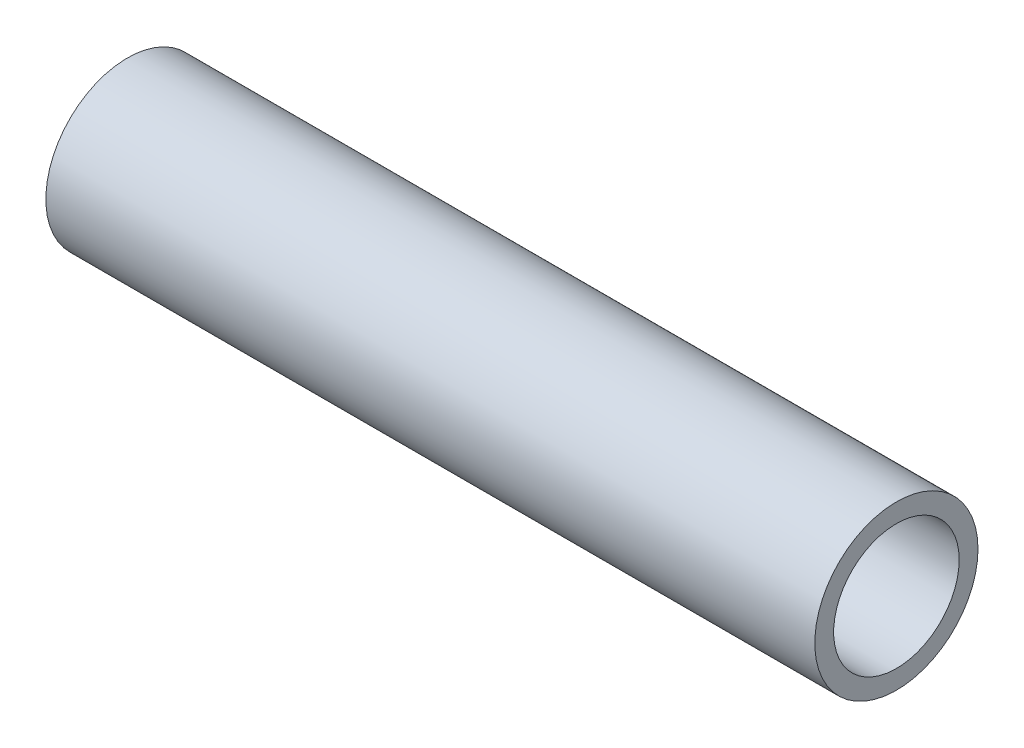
SolidWorks part; units mm, degrees
ref_plane "Front" through (0, 0, 0) normal (0, 0, 1) x (1, 0, 0)
ref_plane "Top" through (0, 0, 0) normal (0, 1, 0) x (1, 0, 0)
ref_plane "Right" through (0, 0, 0) normal (1, 0, 0) x (0, 0, -1)
sketch "Sketch1" plane through (0, 0, 0) normal (0, 0, 1) x (1, 0, 0)
  line L0 (0, 0) -> (155.575, 0)
  line L1 (9.9848, 0) -> (-9.9848, 0) construction
  dimension "D1" = 155.575
other "Structural Member1"
ref_plane "Plane1" through (0, 0, 0) normal (1, 0, 0) x (0, 0, -1)
sketch "Sketch11" plane through (0, 0, 0) normal (1, 0, 0) x (0, 0, -1)
  circle A0 centre (0, 0) radius 12.7
  circle A1 centre (0, 0) radius 16.51
  point P3 (0, 0)
  dimension "D1" = 33.02
  dimension "D2" = 25.4
